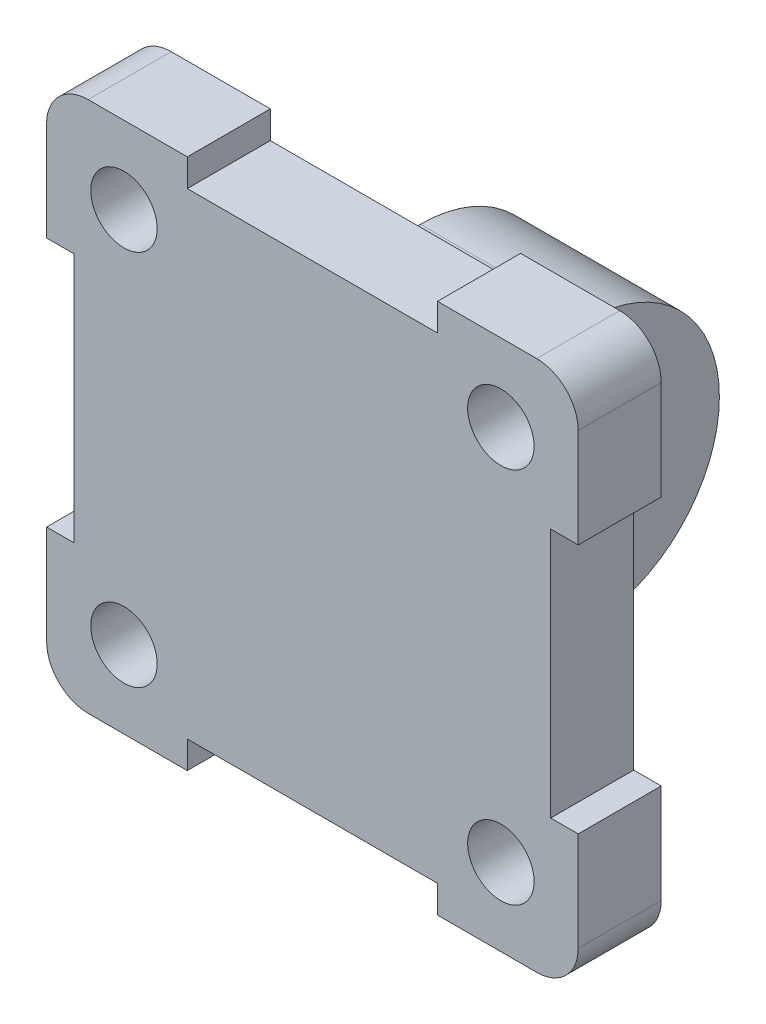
SolidWorks part; units mm, degrees
ref_plane "Front" through (0, 0, 0) normal (0, 0, 1) x (1, 0, 0)
ref_plane "Top" through (0, 0, 0) normal (0, 1, 0) x (1, 0, 0)
ref_plane "Right" through (0, 0, 0) normal (1, 0, 0) x (0, 0, -1)
sketch "Sketch1" plane through (0, 0, 0) normal (0, 0, 1) x (1, 0, 0)
  line L0 (15.065, 32) -> (27, 32)
  line L1 (-27, -32) -> (-15.065, -32)
  line L2 (-32, -27) -> (-32, -15.065)
  line L3 (-27, 32) -> (-15.065, 32)
  line L4 (32, -27) -> (32, -15.065)
  line L5 (-32, -32) -> (32, 32) construction
  line L6 (-32, 32) -> (32, -32) construction
  line L7 (-32, 15.065) -> (-32, 27)
  line L8 (-15.065, 32) -> (-15.065, 28.69)
  line L9 (-15.065, 28.69) -> (15.065, 28.69)
  line L10 (15.065, 32) -> (15.065, 28.69)
  line L11 (-32, 15.065) -> (-28.69, 15.065)
  line L12 (32, 15.065) -> (32, 27)
  line L13 (-32, -15.065) -> (-28.69, -15.065)
  line L14 (-28.69, 15.065) -> (-28.69, -15.065)
  line L16 (-15.065, -32) -> (-15.065, -28.69)
  line L17 (-15.065, -28.69) -> (15.065, -28.69)
  line L18 (15.065, -32) -> (15.065, -28.69)
  line L19 (32, -15.065) -> (28.69, -15.065)
  line L20 (15.065, -32) -> (27, -32)
  line L21 (32, 15.065) -> (28.69, 15.065)
  line L22 (28.69, -15.065) -> (28.69, 15.065)
  arc A0 (-32, -27) -> (-27, -32) centre (-27, -27) ccw
  arc A1 (27, -32) -> (32, -27) centre (27, -27) ccw
  arc A2 (32, 27) -> (27, 32) centre (27, 27) ccw
  arc A3 (-32, 27) -> (-27, 32) centre (-27, 27) cw
  circle A4 centre (-22.69, 22.69) radius 4
  circle A5 centre (22.69, 22.69) radius 4
  circle A6 centre (22.69, -22.69) radius 4
  circle A7 centre (-22.69, -22.69) radius 4
  point P0 (0, 0)
  point P10 (0, 28.69)
  point P23 (-28.69, 0)
  point P24 (28.69, 0)
  point P25 (0, -28.69)
  dimension "D11" = 5
  dimension "D12" = 8
  dimension "D1" = 64
  dimension "D2" = 64
  dimension "D3" = 30.13
  dimension "D4" = 3.31
  dimension "D5" = 3.31
  dimension "D6" = 3.31
  dimension "D7" = 3.31
  dimension "D8" = 30.13
  dimension "D9" = 30.13
  dimension "D10" = 30.13
  dimension "D13" = 22.69
extrude "Boss-Extrude1" add sketch "Sketch1" along normal blind 10
sketch "Sketch2" plane through (0, 0, 0) normal (1, 0, 0) x (0, 0, -1)
  line L0 (0, -15.065) -> (0, 15.065) construction
  line L1 (0, 16) -> (13, 16)
  line L2 (0, 16) -> (0, -16)
  line L3 (0, -16) -> (13, -16)
  line L4 (13, 16) -> (13, -16) construction
  arc A0 (13, 16) -> (13, -16) centre (13, 0) cw
  circle A1 centre (13, 0) radius 8
  point P6 (13, 0)
  dimension "D1" = 32
  dimension "D2" = 13
  dimension "D3" = 16
extrude "Boss-Extrude2" add sketch "Sketch2" along normal mid plane 20
